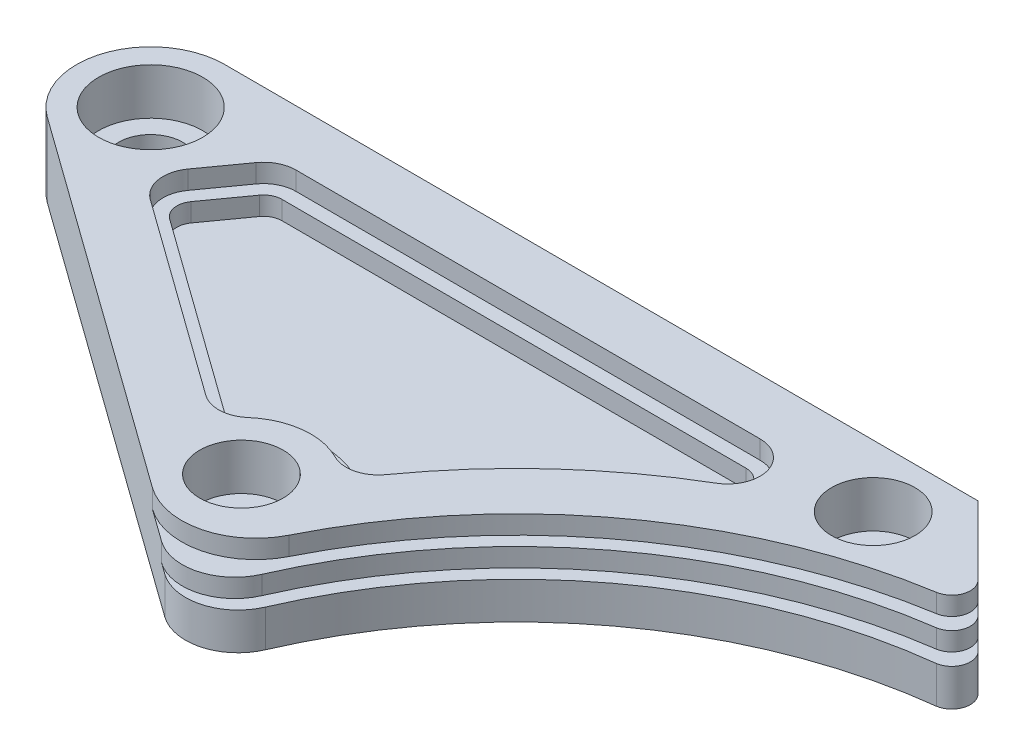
SolidWorks part; units mm, degrees
ref_plane "Front Plane" through (0, 0, 0) normal (0, 0, 1) x (1, 0, 0)
ref_plane "Top Plane" through (0, 0, 0) normal (0, 1, 0) x (1, 0, 0)
ref_plane "Right Plane" through (0, 0, 0) normal (1, 0, 0) x (0, 0, -1)
ref_plane "Plane1" through (0, 0, 12.7) normal (0, 0, 1) x (1, 0, 0)
sketch "Sketch1" plane through (0, 0, 12.7) normal (0, 0, 1) x (1, 0, 0)
  line L0 (-7.4111, -10.3134) -> (69.8175, -65.8092)
  line L1 (141.1153, 0.7224) -> (129.3516, 12.4861)
  line L2 (129.3516, 12.4861) -> (0.021, 12.7)
  arc A0 (69.8175, -65.8092) -> (139.3739, -4.6575) centre (153.1612, -90.4737) cw
  arc A1 (139.3739, -4.6575) -> (141.1153, 0.7224) centre (138.8702, -1.5227) ccw
  arc A2 (0.021, 12.7) -> (-7.4111, -10.3134) centre (0, 0) ccw
extrude "Boss-Extrude1" add sketch "Sketch1" against normal blind 3.175
sketch "Sketch2" plane through (0, 0, 9.525) normal (0, 0, -1) x (-1, 0, 0)
  line L0 (-143.2088, -1.3711) -> (-129.3516, 12.4861)
  line L1 (-129.3516, 12.4861) -> (-0.021, 12.7)
  line L2 (7.4111, -10.3134) -> (-71.8688, -67.2833)
  arc A0 (-71.8688, -67.2833) -> (-141.4674, -6.751) centre (-153.1612, -90.4737) ccw
  arc A1 (-141.4674, -6.751) -> (-143.2088, -1.3711) centre (-140.9637, -3.6162) cw
  arc A2 (-0.021, 12.7) -> (7.4111, -10.3134) centre (0, 0) cw
extrude "Boss-Extrude2" add sketch "Sketch2" along normal blind 3.175
sketch "Sketch3" plane through (0, 0, 6.35) normal (0, 0, -1) x (-1, 0, 0)
  line L0 (-145.3362, -3.4985) -> (-129.3516, 12.4861)
  line L1 (-129.3516, 12.4861) -> (-0.021, 12.7)
  line L2 (7.4111, -10.3134) -> (-73.9277, -68.7628)
  arc A0 (-73.9277, -68.7628) -> (-143.5948, -8.8784) centre (-153.1612, -90.4737) ccw
  arc A1 (-143.5948, -8.8784) -> (-145.3362, -3.4985) centre (-143.0911, -5.7436) cw
  arc A2 (-0.021, 12.7) -> (7.4111, -10.3134) centre (0, 0) cw
extrude "Boss-Extrude3" add sketch "Sketch3" along normal blind 6.35
sketch "Sketch4" plane through (0, 0, 12.7) normal (0, 0, 1) x (1, 0, 0)
  line L0 (9.1316, -10.4716) -> (51.7376, -41.0879)
  line L1 (101.4755, 3.0072) -> (18.9154, 3.1437)
  line L2 (18.9154, 3.1437) -> (9.1316, -10.4716)
  arc A0 (51.7376, -41.0879) -> (71.4907, -39.1811) centre (62.2464, -46.6846) cw
  arc A1 (71.4907, -39.1811) -> (104.2817, -7.3365) centre (153.1612, -90.4737) cw
  arc A2 (104.2817, -7.3365) -> (101.4755, 3.0072) centre (101.4663, -2.5478) ccw
extrude "Cut-Extrude1" cut sketch "Sketch4" against normal blind 3.175
sketch "Sketch5" plane through (0, 0, 9.525) normal (0, 0, 1) x (1, 0, 0)
  line L0 (101.4715, 0.6259) -> (20.1351, 0.7604)
  line L1 (20.1351, 0.7604) -> (20.1084, -15.4271)
  line L2 (20.1084, -15.4271) -> (51.125, -37.7154)
  arc A0 (103.0748, -5.2837) -> (101.4715, 0.6259) centre (101.4663, -2.5478) ccw
  arc A1 (51.125, -37.7154) -> (71.0735, -35.4501) centre (62.2464, -46.6846) cw
  arc A2 (71.0735, -35.4501) -> (103.0748, -5.2837) centre (153.1612, -90.4737) cw
extrude "Cut-Extrude2" cut sketch "Sketch5" against normal blind 3.175
draft "Draft1" type of draft neutral plane draft angle 35.606 faces to draft 1 parameters "D1"=35.606
hole_wizard "Hole1" positions "Sketch7" profile "Sketch6" legacy
sketch "Sketch7" plane through (0, 0, 12.7) normal (0, 0, 1) x (1, 0, 0)
  point P0 (62.2464, -46.6846)
  point P1 (121.9685, 1.9087)
sketch "Sketch6" plane through (62.2464, -46.6846, 12.7) normal (1, 0, 0) x (0, -1, 0)
  line L0 (0, 0) -> (0, 12.7)
  line L1 (0, 12.7) -> (3.9688, 12.7)
  line L2 (3.9688, 12.7) -> (3.9688, 7.9375)
  line L3 (3.9688, 7.9375) -> (7.1438, 7.9375)
  line L4 (7.1438, 7.9375) -> (7.1438, 0)
  line L5 (7.1438, 0) -> (0, 0)
  line L6 (0, 110) -> (0, -10) construction
  dimension "Diameter" = 7.9375
  dimension "Depth" = 12.7
  dimension "C-Bore Diameter" = 14.2875
  dimension "C-Bore Depth" = 7.9375
hole_wizard "CBORE for M10 Hex Head Bolt1" positions "Sketch9" profile "Sketch8" counterbore size "M10" standard "ANSI Metric"
sketch "Sketch9" plane through (0, 0, 12.7) normal (0, 0, 1) x (1, 0, 0)
  point P0 (0, 0)
sketch "Sketch8" plane through (0, 0, 12.7) normal (1, 0, 0) x (0, -1, 0)
  line L0 (0, 0) -> (0, 12.7)
  line L1 (0, 12.7) -> (5.4991, 12.7)
  line L3 (5.4991, 12.7) -> (5.4991, 7.9375)
  line L4 (5.4991, 7.9375) -> (8.9287, 7.9375)
  line L5 (8.9287, 7.9375) -> (8.9287, 0)
  line L7 (8.9287, 0) -> (0, 0)
  line L11 (0, -6.35) -> (0, 107.95) construction
  dimension "Thru Hole Dia." = 10.9982
  dimension "Thru Hole Depth" = 12.7
  dimension "C'Bore Dia." = 17.8575
  dimension "C'Bore Depth" = 7.9375
fillet "Fillet1" radius 12.7 1 edges
fillet "Fillet3" radius 9 1 edges
fillet "Fillet4" radius 3.1737 4 edges at (12.4549, -9.9274, 7.9375) (20.1351, 0.7604, 7.9375) (51.125, -37.7154, 7.9375) (71.0735, -35.4501, 7.9375)
fillet "Fillet5" radius 5.555 4 edges at (51.7376, -41.0879, 11.1125) (18.9154, 3.1437, 11.1125) (9.1316, -10.4716, 11.1125) (71.4907, -39.1811, 11.1125)
fillet "Fillet6" radius 9 1 edges at (73.9277, -68.7628, 3.175)
move or copy body "Body-Move/Copy1" bodies to move or copy 109 copy no rotation origin (0, -25.3735, 6.35) rotation axis (-1, 0, 0) rotation angle 90
